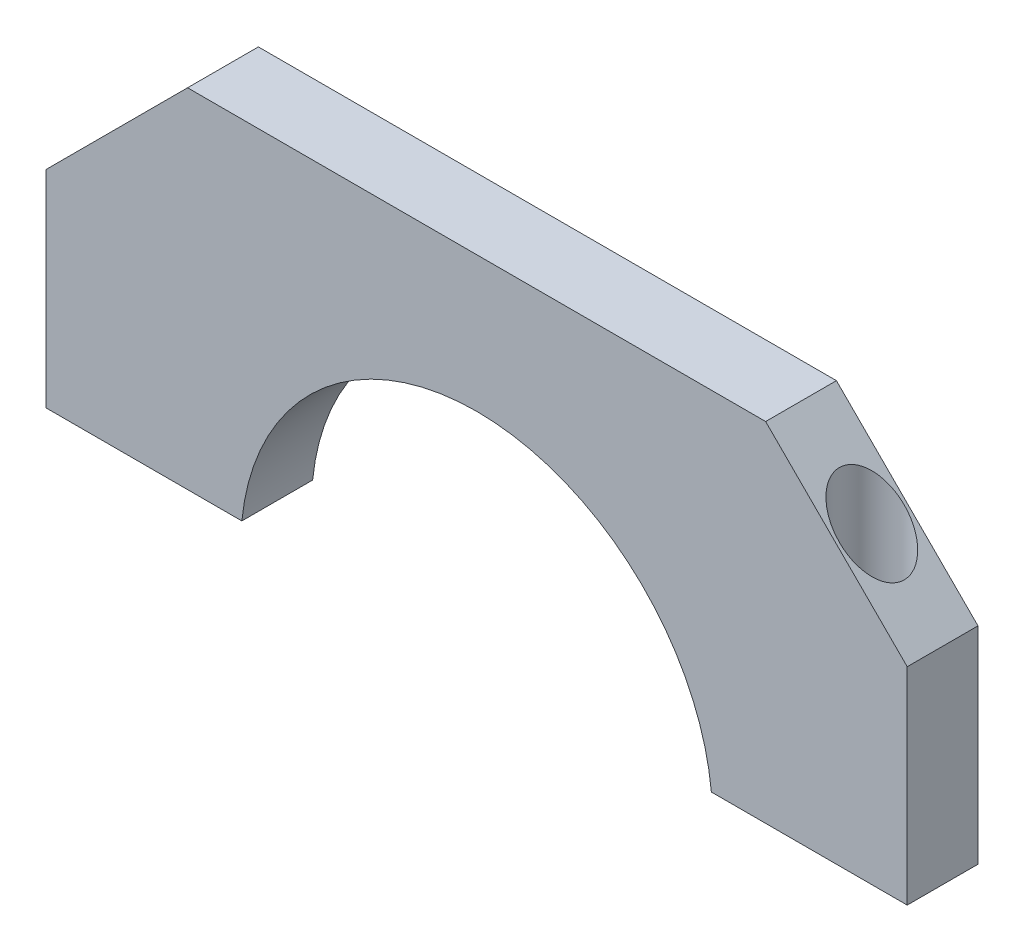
SolidWorks part; units mm, degrees
ref_plane "Front Plane" through (0, 0, 0) normal (0, 0, 1) x (1, 0, 0)
ref_plane "Top Plane" through (0, 0, 0) normal (0, 1, 0) x (1, 0, 0)
ref_plane "Right Plane" through (0, 0, 0) normal (1, 0, 0) x (0, 0, -1)
sketch "Sketch1" plane through (0, 0, 0) normal (0, 0, 1) x (1, 0, 0)
  line L0 (-73, 5.5) -> (-49, 29.5)
  line L1 (-73, -29.5) -> (-39.7995, -29.5)
  line L2 (-73, -29.5) -> (-73, 5.5)
  line L3 (-49, 29.5) -> (49, 29.5)
  line L4 (73, -29.5) -> (73, 5.5)
  line L5 (-73, -29.5) -> (73, 29.5) construction
  line L6 (-73, 29.5) -> (73, -29.5) construction
  line L7 (49, 29.5) -> (73, 5.5)
  line L8 (39.7995, -29.5) -> (73, -29.5)
  arc A0 (39.7995, -29.5) -> (-39.7995, -29.5) centre (0, -33.5) ccw
  point P0 (0, 0)
  point P11 (0, -33.3117)
  point P12 (-73, 29.5)
  dimension "D3" = 40
  dimension "D1" = 59
  dimension "D2" = 146
  dimension "D4" = 4
extrude "Boss-Extrude1" add sketch "Sketch1" along normal blind 12
sketch "Sketch3" plane through (0, 29.5, 0) normal (0, 1, 0) x (1, 0, 0)
  line L0 (-49, 0) -> (-73, 0) construction
  line L1 (73, 0) -> (49, 0) construction
  line L2 (73, -12) -> (73, 0) construction
  line L3 (-73, -12) -> (-73, 0) construction
  circle A0 centre (-61, -6) radius 5.5
  circle A1 centre (61, -6) radius 5.5
  dimension "D1" = 11
  dimension "D2" = 11
  dimension "D3" = 6
  dimension "D4" = 6
  dimension "D5" = 12
  dimension "D6" = 12
extrude "Cut-Extrude1" cut sketch "Sketch3" against normal blind 39
sketch "Sketch5" plane through (0, -9.5, 0) normal (0, 1, 0) x (1, 0, 0)
  circle A0 centre (61, -6) radius 3.25
  circle A1 centre (-61, -6) radius 3.25
  dimension "D1" = 6.5
  dimension "D2" = 6.5
extrude "Cut-Extrude2" cut sketch "Sketch5" against normal up to next
